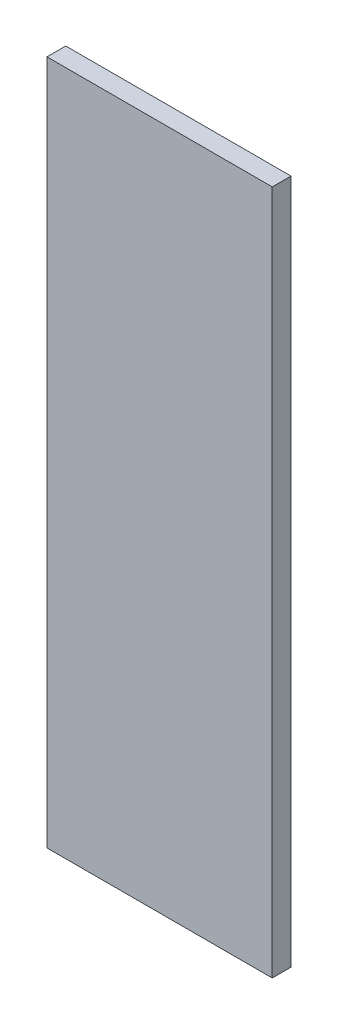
SolidWorks part; units mm, degrees
ref_plane "Front Plane" through (0, 0, 0) normal (0, 0, 1) x (1, 0, 0)
ref_plane "Top Plane" through (0, 0, 0) normal (0, 1, 0) x (1, 0, 0)
ref_plane "Right Plane" through (0, 0, 0) normal (1, 0, 0) x (0, 0, -1)
sketch "Sketch1" plane through (0, 0, 0) normal (0, 0, 1) x (1, 0, 0)
  line L1 (-6, 18.25) -> (6, 18.25)
  line L2 (-6, 18.25) -> (-6, -18.25)
  line L3 (-6, -18.25) -> (6, -18.25)
  line L4 (6, 18.25) -> (6, -18.25)
  point P4 (0, 18.25)
  point P6 (-6, 0)
  dimension "D1" = 12
  dimension "D2" = 36.5
extrude "Tape" add sketch "Sketch1" along normal blind 1
